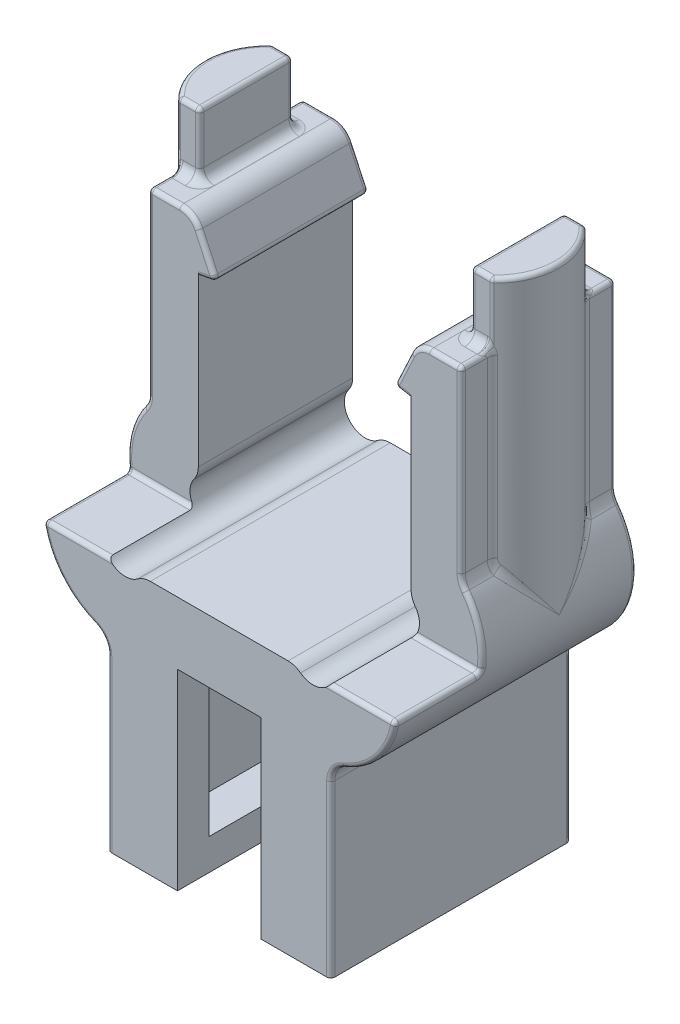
SolidWorks part; units mm, degrees
ref_plane "Front Plane" through (0, 0, 0) normal (0, 0, 1) x (1, 0, 0)
ref_plane "Top Plane" through (0, 0, 0) normal (0, 1, 0) x (1, 0, 0)
ref_plane "Right Plane" through (0, 0, 0) normal (1, 0, 0) x (0, 0, -1)
sketch "Sketch1" plane through (0, 0, 0) normal (0, 1, 0) x (-1, 0, 0)
  line L0 (-1.875, 8.0563) -> (-1.875, 12.7) construction
  line L1 (-1.875, 12.7) -> (1.875, 12.7) construction
  line L2 (1.875, 12.7) -> (1.875, 8.0563) construction
  line L3 (-6.25, 1.7379) -> (-6.25, -0.55) construction
  line L4 (6.25, 1.7379) -> (6.25, -0.55) construction
  line L5 (5, -1.8) -> (3.85, -1.8) construction
  line L6 (3.85, -1.8) -> (1.1627, -1.3232) construction
  line L7 (0.75, -0.8309) -> (0.75, -0.6) construction
  line L8 (0.75, -0.6) -> (-0.75, -0.6) construction
  line L9 (-0.75, -0.6) -> (-0.75, -0.8309) construction
  line L10 (-1.1627, -1.3232) -> (-3.85, -1.8) construction
  line L11 (-3.85, -1.8) -> (-5, -1.8) construction
  line L12 (0, -0.6) -> (0, -6.35) construction
  line L13 (-6.35, 0) -> (6.35, 0) construction
  line L14 (0, -6.35) -> (0, 12.7) construction
  arc A0 (6.25, 1.7379) -> (2.1991, 7.5882) centre (0, 1.7379) ccw construction
  arc A1 (-6.25, 1.7379) -> (-2.1991, 7.5882) centre (0, 1.7379) cw construction
  arc A4 (6.25, -0.55) -> (5, -1.8) centre (5, -0.55) cw construction
  arc A5 (-6.25, -0.55) -> (-5, -1.8) centre (-5, -0.55) ccw construction
  arc A6 (1.1627, -1.3232) -> (0.75, -0.8309) centre (1.25, -0.8309) cw construction
  arc A7 (-0.75, -0.8309) -> (-1.1627, -1.3232) centre (-1.25, -0.8309) cw construction
  arc A8 (1.875, 8.0563) -> (2.1991, 7.5882) centre (2.375, 8.0563) ccw construction
  arc A9 (-2.1991, 7.5882) -> (-1.875, 8.0563) centre (-2.375, 8.0563) ccw construction
  circle A10 centre (0, 0) radius 4.25 construction
  point P16 (0, -0.6)
  point P17 (0, 12.7)
  point P34 (0.75, -1.25)
  point P39 (1.875, 7.7)
  dimension "D9" = 1.25
  dimension "D11" = 0.5
  dimension "D13" = 8.5
  dimension "D1" = 3.75
  dimension "D2" = 12.5
  dimension "D3" = 14.5
  dimension "D4" = 5.75
  dimension "D5" = 1.5
  dimension "D6" = 19.05
  dimension "D7" = 5
  dimension "D8" = 0.65
  dimension "D12" = 0.6
ref_plane "Plane1" through (0, 0, 12.7) normal (0, 0, 1) x (1, 0, 0)
sketch "Sketch3" plane through (0, 0, 12.7) normal (0, 0, 1) x (1, 0, 0)
  line L0 (1.875, 0) -> (-1.875, 0) construction
  line L1 (-1.925, 0.05) -> (1.925, 0.05)
  line L2 (-1.925, 0.05) -> (-1.925, -3.8)
  line L3 (-1.925, -3.8) -> (1.925, -3.8)
  line L4 (1.925, 0.05) -> (1.925, -3.8)
  line L5 (-2.675, 0.8) -> (-2.675, -4.55)
  line L10 (-2.675, -4.55) -> (2.675, -4.55)
  line L11 (2.675, 0.8) -> (2.675, -4.55)
  line L12 (-2.675, 0.8) -> (2.675, 0.8)
  dimension "D1" = 3.85
  dimension "D2" = 0.05
  dimension "D3" = 0.05
  dimension "D4" = 0.75
extrude "Boss-Extrude1" add sketch "Sketch3" against normal blind 5
sketch "Sketch4" plane through (0, 0, 12.7) normal (0, 0, 1) x (1, 0, 0)
  line L0 (-1.925, -3.8) -> (1.925, -3.8) construction
  line L1 (-1, -3.8) -> (1, -3.8)
  line L2 (-1, -3.8) -> (-1, -4.55)
  line L3 (-1, -4.55) -> (1, -4.55)
  line L4 (1, -3.8) -> (1, -4.55)
  line L5 (-2.675, -4.55) -> (2.675, -4.55) construction
  line L6 (-1.925, 0.05) -> (-1.925, -3.8) construction
  dimension "D1" = 2
  dimension "D2" = 0.925
extrude "Cut-Extrude1" cut sketch "Sketch4" against normal blind 5
sketch "Sketch5" plane through (0, 0, 12.7) normal (0, 0, 1) x (1, 0, 0)
  line L0 (-1, -4.55) -> (-1, 0.05)
  line L1 (1.925, 0.05) -> (-1.925, 0.05) construction
  line L2 (-1, 0.05) -> (1, 0.05)
  line L3 (1, 0.05) -> (1, -4.55)
  line L4 (1, -4.55) -> (2.675, -4.55)
  line L5 (2.675, -4.55) -> (2.675, 0.8)
  line L6 (2.675, 0.8) -> (-2.675, 0.8)
  line L7 (-2.675, 0.8) -> (-2.675, -4.55)
  line L8 (-2.675, -4.55) -> (-1, -4.55)
extrude "Boss-Extrude2" add sketch "Sketch5" along normal blind 0.75
sketch "Sketch6" plane through (0, 0.8, 0) normal (0, 1, 0) x (1, 0, 0)
  line L0 (2.675, -13.45) -> (-2.675, -13.45) construction
  line L1 (-3.75, -7.7) -> (3.75, -7.7)
  line L2 (-3.75, -7.7) -> (-3.75, -13.45)
  line L3 (-3.75, -13.45) -> (3.75, -13.45)
  line L4 (3.75, -7.7) -> (3.75, -13.45)
  line L5 (2.675, -7.7) -> (-2.675, -7.7) construction
  line L6 (-2.675, -7.7) -> (-2.675, -13.45) construction
  line L7 (-3.75, -10.575) -> (-2.675, -10.575) construction
  line L8 (3.75, -10.575) -> (2.675, -10.575) construction
  line L9 (2.675, -7.7) -> (2.675, -13.45) construction
  dimension "D1" = 7.5
extrude "Boss-Extrude3" add sketch "Sketch6" along normal offset from surface (0.75 mm away) 1.5
sketch "Sketch12" plane through (0, 0.8, 0) normal (0, -1, 0) x (1, 0, 0)
  line L1 (3.75, 7.7) -> (2.675, 7.7)
  line L2 (3.75, 7.7) -> (3.75, 13.45)
  line L3 (3.75, 13.45) -> (2.675, 13.45)
  line L4 (2.675, 7.7) -> (2.675, 13.45)
  line L5 (-2.675, 7.7) -> (-3.75, 7.7)
  line L6 (-2.675, 7.7) -> (-2.675, 13.45)
  line L7 (-2.675, 13.45) -> (-3.75, 13.45)
  line L8 (-3.75, 7.7) -> (-3.75, 13.45)
sketch "Sketch8" plane through (0, 1.55, 0) normal (0, 1, 0) x (1, 0, 0)
  line L0 (-3.75, -13.45) -> (3.75, -13.45) construction
  line L1 (-3.75, -7.7) -> (-2.55, -7.7)
  line L2 (-3.75, -7.7) -> (-3.75, -13.45)
  line L3 (-3.75, -13.45) -> (-2.55, -13.45)
  line L4 (-2.55, -7.7) -> (-2.55, -13.45)
  line L6 (3.75, -7.7) -> (2.55, -7.7)
  line L7 (3.75, -7.7) -> (3.75, -13.45)
  line L8 (3.75, -13.45) -> (2.55, -13.45)
  line L9 (2.55, -7.7) -> (2.55, -13.45)
  dimension "D1" = 5.1
extrude "Boss-Extrude4" add sketch "Sketch8" along normal blind 6.1
sketch "Sketch11" plane through (0, 0, 7.7) normal (0, 0, -1) x (-1, 0, 0)
  line L0 (-2.25, 1.85) -> (-2.55, 1.85) construction
  line L1 (-2.55, 7.65) -> (-2.55, 1.55) construction
  line L2 (-2.25, 1.85) -> (-2.25, 1.55) construction
  line L3 (-2.55, 1.55) -> (2.55, 1.55) construction
  line L4 (-2.55, 2.45) -> (-2.55, 1.55)
  line L5 (-2.55, 1.55) -> (-1.65, 1.55)
  line L6 (-3.05, 2.45) -> (-2.55, 2.45) construction
  line L7 (-1.65, 1.05) -> (-1.65, 1.55) construction
  line L8 (0, 6.71) -> (0, -6.71) construction
  line L9 (2.55, 2.45) -> (2.55, 1.55)
  line L10 (2.55, 1.55) -> (1.65, 1.55)
  arc A0 (-2.65, 2.15) -> (-1.95, 1.45) centre (-2.25, 1.85) ccw
  arc A1 (-1.95, 1.45) -> (-1.65, 1.55) centre (-1.65, 1.05) cw
  arc A2 (-2.65, 2.15) -> (-2.55, 2.45) centre (-3.05, 2.45) ccw
  arc A3 (2.65, 2.15) -> (2.55, 2.45) centre (3.05, 2.45) cw
  arc A4 (2.65, 2.15) -> (1.95, 1.45) centre (2.25, 1.85) cw
  arc A5 (1.95, 1.45) -> (1.65, 1.55) centre (1.65, 1.05) ccw
  dimension "D1" = 0.5
  dimension "D2" = 0.3
  dimension "D3" = 0.5
extrude "Cut-Extrude3" cut sketch "Sketch11" against normal through all
sketch "Sketch13" plane through (0, 0, 7.7) normal (0, 0, -1) x (-1, 0, 0)
  line L10 (-3.75, 3.35) -> (-3.75, 0.8)
  line L11 (-2.675, -0.4726) -> (-2.675, 0.8)
  line L12 (-3.75, 2.65) -> (-3.75, 7.65)
  line L13 (3.75, 7.65) -> (3.75, 2.65)
  line L14 (1.45, 0.35) -> (-1.45, 0.35)
  line L15 (-3.75, 2.65) -> (-3.75, 7.65) construction
  line L16 (3.75, 7.65) -> (3.75, 2.65) construction
  line L17 (1.45, 0.35) -> (-1.45, 0.35) construction
  line L19 (-2.675, 0.8) -> (-3.75, 0.8)
  line L20 (-2.675, -4.55) -> (-2.675, 0.8) construction
  line L21 (0, 6.71) -> (0, -6.71) construction
  line L22 (2.675, -0.4726) -> (2.675, 0.8)
  line L23 (2.675, 0.8) -> (3.75, 0.8)
  line L24 (3.75, 3.35) -> (3.75, 0.8)
  arc A36 (-2.99, -0.0081) -> (-3.85, 3.05) centre (-2.25, 1.85) cw
  arc A37 (-3.85, 3.05) -> (-3.75, 3.35) centre (-4.25, 3.35) ccw
  arc A38 (-2.65, 2.15) -> (-1.95, 1.45) centre (-2.25, 1.85) ccw construction
  arc A39 (-2.99, -0.0081) -> (-2.675, -0.4726) centre (-3.175, -0.4726) cw
  arc A40 (3.85, 3.05) -> (3.75, 3.35) centre (4.25, 3.35) cw
  arc A41 (2.99, -0.0081) -> (3.85, 3.05) centre (2.25, 1.85) ccw
  arc A42 (1.45, 0.35) -> (3.75, 2.65) centre (2.25, 1.85) ccw
  arc A43 (-3.75, 2.65) -> (-1.45, 0.35) centre (-2.25, 1.85) ccw
  arc A44 (1.45, 0.35) -> (3.75, 2.65) centre (2.25, 1.85) ccw construction
  arc A45 (-3.75, 2.65) -> (-1.45, 0.35) centre (-2.25, 1.85) ccw construction
  arc A46 (2.99, -0.0081) -> (2.675, -0.4726) centre (3.175, -0.4726) ccw
  dimension "D2" = 1.5
  dimension "D3" = 0.5
  dimension "D4" = 0.5
  dimension "D1" = 1.2
extrude "Boss-Extrude7" add sketch "Sketch13" against normal through all
sketch "Sketch9" plane through (0, 0, 13.45) normal (0, 0, 1) x (1, 0, 0)
  line L0 (-2.55, 7.65) -> (-2.0137, 6.5)
  line L1 (-2.0137, 6.5) -> (-2.55, 6.4)
  line L2 (-2.55, 7.65) -> (-2.55, 2.45) construction
  line L3 (-2.55, 6.4) -> (-2.55, 7.65)
  line L5 (0, -6.71) -> (0, 6.71) construction
  line L6 (2.0137, 6.5) -> (2.55, 6.4)
  line L7 (2.55, 7.65) -> (2.0137, 6.5)
  line L8 (2.55, 6.4) -> (2.55, 7.65)
  dimension "D1" = 25
  dimension "D2" = 1.25
  dimension "D3" = 1.15
extrude "Boss-Extrude5" add sketch "Sketch9" against normal up to surface (5.75 mm away)
sketch "Sketch14" plane through (0, 0, 13.45) normal (0, 0, 1) x (1, 0, 0)
  line L0 (-2.675, 7.65) -> (-2.55, 7.65)
  line L1 (-3.75, 7.65) -> (-2.55, 7.65) construction
  line L2 (-2.55, 7.65) -> (-2.0137, 6.5)
  line L3 (-2.0137, 6.5) -> (-2.1287, 6.4786)
  line L4 (-2.55, 6.4) -> (-2.0137, 6.5) construction
  line L5 (-2.1287, 6.4786) -> (-2.675, 7.65)
  line L6 (2.0137, 6.5) -> (2.55, 7.65)
  line L7 (2.55, 7.65) -> (2.675, 7.65)
  line L8 (2.55, 7.65) -> (3.75, 7.65) construction
  line L9 (2.675, 7.65) -> (2.1287, 6.4786)
  line L10 (2.0137, 6.5) -> (2.55, 6.4) construction
  line L11 (2.1287, 6.4786) -> (2.0137, 6.5)
  line L12 (-2.55, 6.4) -> (-2.55, 2.45) construction
  dimension "D1" = 0.125
extrude "Cut-Extrude4" cut sketch "Sketch14" against normal through all
fillet "Fillet2" radius 0.1 2 edges at (2.1287, 6.4786, 10.575) (-2.1287, 6.4786, 10.575)
fillet "Fillet1" radius 0.5 2 edges at (2.675, 7.65, 10.575) (-2.675, 7.65, 10.575)
sketch "Sketch10" plane through (3.75, 0, 0) normal (1, 0, 0) x (0, 0, -1)
  line L0 (-7.7, 1.55) -> (-13.45, 1.55) construction
  line L1 (-11.4, 7.65) -> (-13.45, 7.65)
  line L2 (-11.4, 7.65) -> (-11.4, 1.55)
  line L3 (-11.4, 1.55) -> (-13.45, 1.55)
  line L4 (-13.45, 7.65) -> (-13.45, 1.55)
  line L5 (-13.45, 7.65) -> (-7.7, 7.65) construction
  line L6 (-13.45, 7.65) -> (-13.45, 3.35) construction
  dimension "D1" = 12
extrude "Cut-Extrude2" cut sketch "Sketch10" against normal through all and the other way through all
sketch "Sketch16" plane through (0, 7.65, 0) normal (0, 1, 0) x (1, 0, 0)
  line L0 (-3.75, -9.55) -> (49996.25, -9.55) construction
  line L1 (-3.75, -7.7) -> (-3.75, -11.4) construction
  line L2 (3.75, -11.4) -> (3.75, -7.7) construction
  line L3 (-4.25, -6.7741) -> (-4.25, -50006.7741) construction
  line L4 (-3.75, -8.432) -> (-3.75, -10.668)
  line L5 (0, -6.71) -> (0, 6.71) construction
  line L6 (3.75, -8.432) -> (3.75, -10.668)
  arc A0 (-3.75, -10.668) -> (-3.75, -8.432) centre (-2.75, -9.55) cw
  arc A1 (3.75, -10.668) -> (3.75, -8.432) centre (2.75, -9.55) ccw
  point P4 (-3.75, -9.55)
  point P7 (3.75, -9.55)
  dimension "D1" = 1.5
extrude "Boss-Extrude8" add sketch "Sketch16" against normal up to next
sketch "Sketch17" plane through (0, 7.65, 0) normal (0, 1, 0) x (1, 0, 0)
  line L0 (-3.75, -8.432) -> (-3.25, -8.432)
  line L1 (-3.25, -8.432) -> (-3.25, -10.668)
  line L2 (-3.25, -10.668) -> (-3.75, -10.668)
  line L3 (0, -6.71) -> (0, 6.71) construction
  line L4 (3.25, -8.432) -> (3.25, -10.668)
  line L5 (3.75, -8.432) -> (3.25, -8.432)
  line L6 (3.25, -10.668) -> (3.75, -10.668)
  arc A0 (-3.75, -10.668) -> (-3.75, -8.432) centre (-2.75, -9.55) cw
  arc A1 (-3.75, -8.432) -> (-3.75, -10.668) centre (-2.75, -9.55) ccw construction
  arc A2 (3.75, -10.668) -> (3.75, -8.432) centre (2.75, -9.55) ccw
  dimension "D1" = 0.5
extrude "Boss-Extrude9" add sketch "Sketch17" along normal blind 1.5
fillet "Fillet5" radius 0.1 52 edges at (2.7612, -0.192, 13.45) (2.7612, -0.192, 7.7) (3.7757, 3.1919, 7.7) (4.1753, 1.3086, 7.7) (-2.675, -2.5113, 13.45) (-2.675, -2.5113, 7.7) (-3.8162, 0.6062, 13.45) (-2.7612, -0.192, 13.45) (-4.1753, 1.3086, 7.7) (2.675, -2.5113, 7.7) (-3.7757, 3.1919, 7.7) (-2.7612, -0.192, 7.7) (-2.4028, 6.4275, 7.7) (2.3618, 6.9784, 7.7) (2.4028, 6.4275, 7.7) (-2.185, 6.5075, 7.7) (2.185, 6.5075, 7.7) (-3.3718, 7.65, 7.7) (-2.3618, 6.9784, 7.7) (-2.7249, 7.5717, 7.7) (2.7249, 7.5717, 7.7) (-2.7249, 7.5717, 11.4) (-4.2274, 1.55, 12.425) (3.8162, 0.6062, 13.45) (3.75, 7.65, 11.034) (3.4387, 1.55, 11.4) (-3.4387, 1.55, 11.4) (4.2274, 1.55, 12.425) (3.3718, 7.65, 11.4) (3.75, 5.5, 11.4) (2.3618, 6.9784, 11.4) (4.1896, 2.338, 11.4) (-3.75, 5.5, 11.4) (-3.3718, 7.65, 11.4) (-2.3618, 6.9784, 11.4) (-4.1896, 2.338, 11.4) (3.7757, 3.1919, 11.4) (-3.7757, 3.1919, 11.4) (3.4387, 1.55, 13.45) (-3.4387, 1.55, 13.45) (-2.4028, 6.4275, 11.4) (-2.185, 6.5075, 11.4) (2.7249, 7.5717, 11.4) (2.185, 6.5075, 11.4) (2.4028, 6.4275, 11.4) (-3.75, 7.65, 11.034) (3.75, 7.65, 8.066) (2.675, -2.5113, 13.45) (-3.75, 5.5, 7.7) (3.75, 5.5, 7.7) (-3.75, 7.65, 8.066) (3.3718, 7.65, 7.7)
fillet "Fillet4" radius 0.1 16 edges at (-3.5, 9.15, 8.432) (-3.25, 9.15, 9.55) (-3.5, 9.15, 10.668) (-4.25, 9.15, 9.55) (-3.25, 8.4, 10.668) (-3.75, 8.35, 10.668) (-3.25, 8.4, 8.432) (-3.75, 8.35, 8.432) (4.25, 9.15, 9.55) (3.5, 9.15, 10.668) (3.25, 9.15, 9.55) (3.5, 9.15, 8.432) (3.75, 8.35, 10.668) (3.25, 8.4, 10.668) (3.75, 8.35, 8.432) (3.25, 8.4, 8.432)
fillet "Fillet3" radius 0.25 34 edges at (-4.1819, 2.3673, 9.1033) (-4.1819, 2.3673, 9.9967) (4.1819, 2.3673, 9.9967) (4.1819, 2.3673, 9.1033) (3.5, 7.65, 8.432) (-3.5, 7.65, 10.668) (3.6822, 7.6447, 10.668) (-3.6822, 7.6447, 8.432) (3.8142, 3.1048, 8.4929) (3.5, 7.65, 10.668) (3.25, 7.65, 9.55) (3.6822, 7.6447, 8.432) (-3.5, 7.65, 8.432) (-3.25, 7.65, 9.55) (-3.6822, 7.6447, 10.668) (-3.8142, 3.1048, 10.6071) (3.7565, 3.2695, 10.6571) (3.75, 5.45, 10.6601) (3.7447, 7.5822, 10.6622) (3.2793, 7.65, 10.6387) (3.7333, 7.6054, 8.4345) (3.75, 5.45, 8.4399) (3.7715, 3.2051, 8.4523) (3.2793, 7.65, 8.4613) (-3.2793, 7.65, 10.6387) (-3.7333, 7.6054, 10.6655) (-3.75, 5.45, 10.6601) (-3.7715, 3.2051, 10.6477) (-3.2793, 7.65, 8.4613) (-3.7565, 3.2695, 8.4429) (-3.75, 5.45, 8.4399) (-3.7447, 7.5822, 8.4378)
